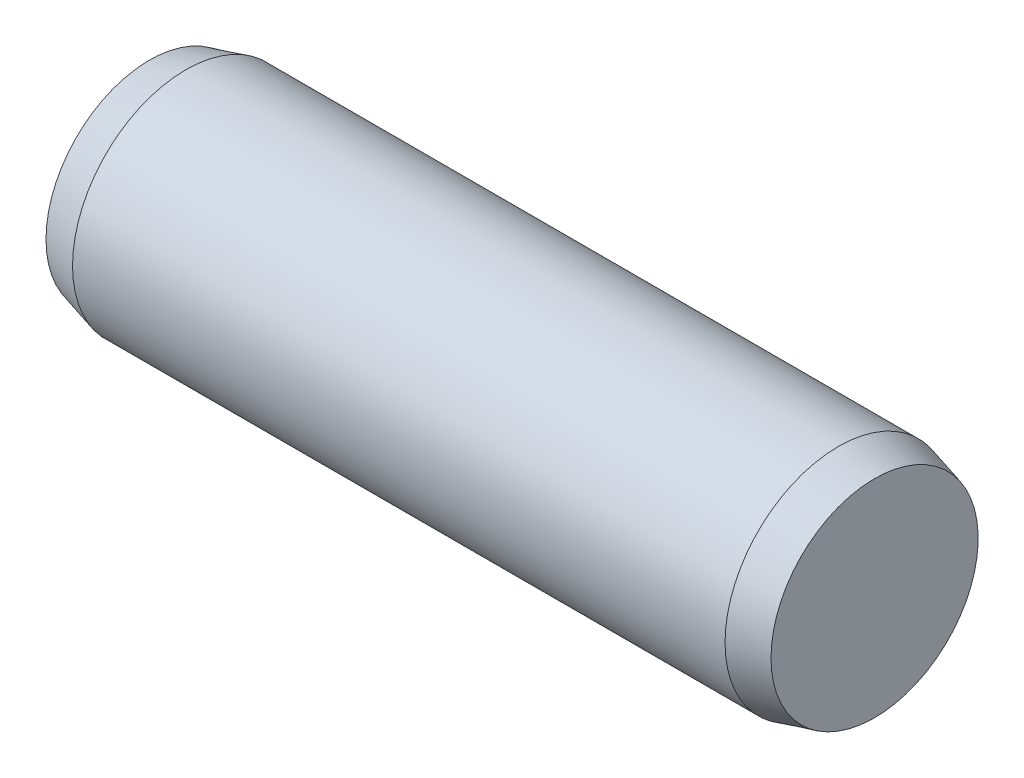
SolidWorks part; units mm, degrees
ref_plane "Plane1" through (0, 0, 0) normal (0, 0, 1) x (1, 0, 0)
ref_plane "Plane2" through (0, 0, 0) normal (0, 1, 0) x (1, 0, 0)
ref_plane "Plane3" through (0, 0, 0) normal (1, 0, 0) x (0, 0, -1)
sketch "Sketch1" plane through (0, 0, 0) normal (0, 0, 1) x (1, 0, 0)
  line L1 (-6.35, 0) -> (107.95, 0) construction
  line L2 (0, 0) -> (16, 0)
  line L3 (16, 0) -> (16, 2.2856)
  line L4 (16, 2.2856) -> (15.2, 2.5)
  line L5 (15.2, 2.5) -> (0.8, 2.5)
  line L6 (0, 2.2856) -> (0, 0)
  line L7 (0, 2.2856) -> (0.8, 2.5)
revolve "Base-Revolve" add sketch "Sketch1" angle 360 about L1
equation "\"D3@Sketch1\" = 15.0"
equation "\"D1@Sketch1\" = \"Chamfer_len@Sketch1\""
equation "\"D2@Sketch1\" = \"D3@Sketch1\""
